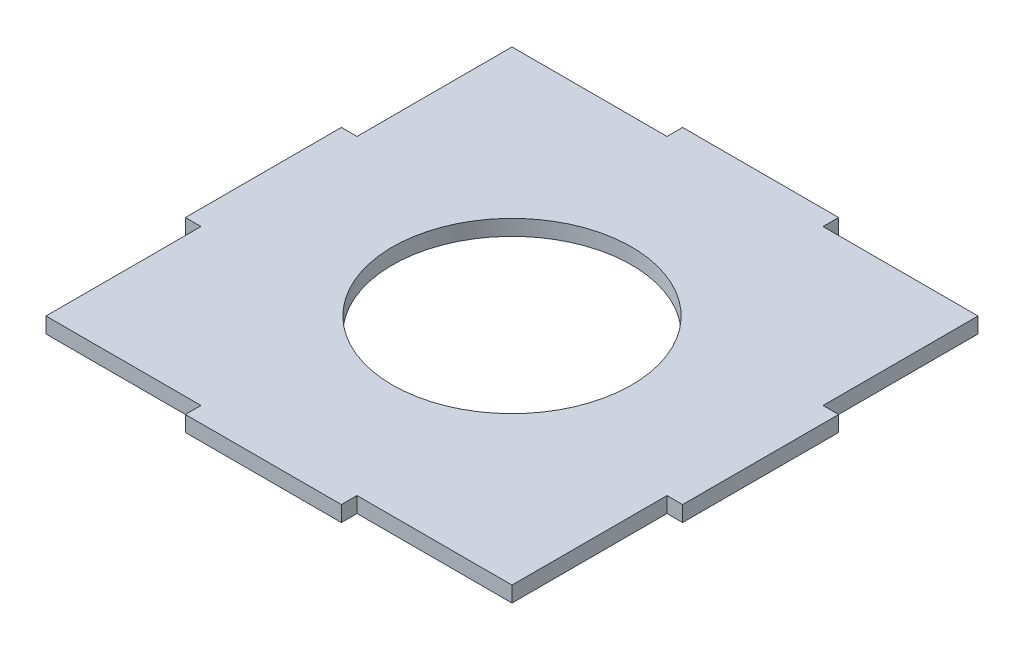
SolidWorks part; units mm, degrees
ref_plane "Front Plane" through (0, 0, 0) normal (0, 0, 1) x (1, 0, 0)
ref_plane "Top Plane" through (0, 0, 0) normal (0, 1, 0) x (1, 0, 0)
ref_plane "Right Plane" through (0, 0, 0) normal (1, 0, 0) x (0, 0, -1)
sketch "Sketch1" plane through (0, 0, 0) normal (0, 1, 0) x (1, 0, 0)
  line L1 (-44.8, 44.8) -> (44.8, 44.8)
  line L2 (-44.8, 44.8) -> (-44.8, -44.8)
  line L3 (-44.8, -44.8) -> (44.8, -44.8)
  line L4 (44.8, 44.8) -> (44.8, -44.8)
  point P4 (0, 44.8)
  point P6 (-44.8, 0)
extrude "Boss-Extrude1" add sketch "Sketch1" along normal blind 3
sketch "Sketch2" plane through (0, 3, 0) normal (0, 1, 0) x (1, 0, 0)
  line L0 (-44.8, 44.8) -> (-44.8, -44.8) construction
  line L1 (-44.8, 15) -> (-47.8, 15)
  line L2 (-44.8, 15) -> (-44.8, -15)
  line L3 (-44.8, -15) -> (-47.8, -15)
  line L4 (-47.8, 15) -> (-47.8, -15)
  line L5 (44.8, -44.8) -> (44.8, 44.8) construction
  point P6 (-44.8, 0)
  point P9 (44.8, 0)
extrude "Boss-Extrude2" add sketch "Sketch2" against normal blind 3
sketch "Sketch3" plane through (0, 0, 0) normal (0, 0, 1) x (1, 0, 0)
  line L0 (0, 30.8072) -> (0, -8.2065) construction
pattern_circular "CirPattern1" count 4 over 360 about axis through (0, 0, 0) along (0, 1, 0) of "Boss-Extrude2"
sketch "Sketch4" plane through (0, 3, 0) normal (0, 1, 0) x (1, 0, 0)
  circle A0 centre (0, 0) radius 23
extrude "Cut-Extrude1" cut sketch "Sketch4" against normal through all
equation "\"ExternalDiameterBallBearing\"= 22mm"
equation "\"InternalDiameterBallBearing\"= 8mm"
equation "\"WidthJoints\"= 3mm"
equation "\"LenghtJoints\"= 7mm"
equation "\"HeightJoints\"= 40mm"
equation "\"DeepnessJoints\"= 60mm"
equation "\"TurbineShaftDiameter\"= 40mm"
equation "\"HeightTurbine\"= 180mm"
equation "\"HeightBase\"= 20mm"
equation "\"HeightBlade\"= 180mm"
equation "\"HeightBallBearing\"= 7mm"
equation "\"HeightBox\"= 40mm"
equation "\"LenghtBlade\"= 60mm"
equation "\"Lsqare\"= 90mm"
equation "\"lenghtJointsForBox\"=30mm"
equation "\"Error\"=0.4mm"
equation "\"D1@Sketch1\"=\"Lsqare\"-\"Error\""
equation "\"D2@Sketch1\"=\"Lsqare\"-\"Error\""
equation "\"D1@Boss-Extrude1\"=\"WidthJoints\""
equation "\"D1@Sketch2\"=\"WidthJoints\""
equation "\"D2@Sketch2\"=\"lenghtJointsForBox\""
equation "\"D1@Boss-Extrude2\"=\"WidthJoints\""
equation "\"D1@Sketch4\"=\"TurbineShaftDiameter\"+6mm"
